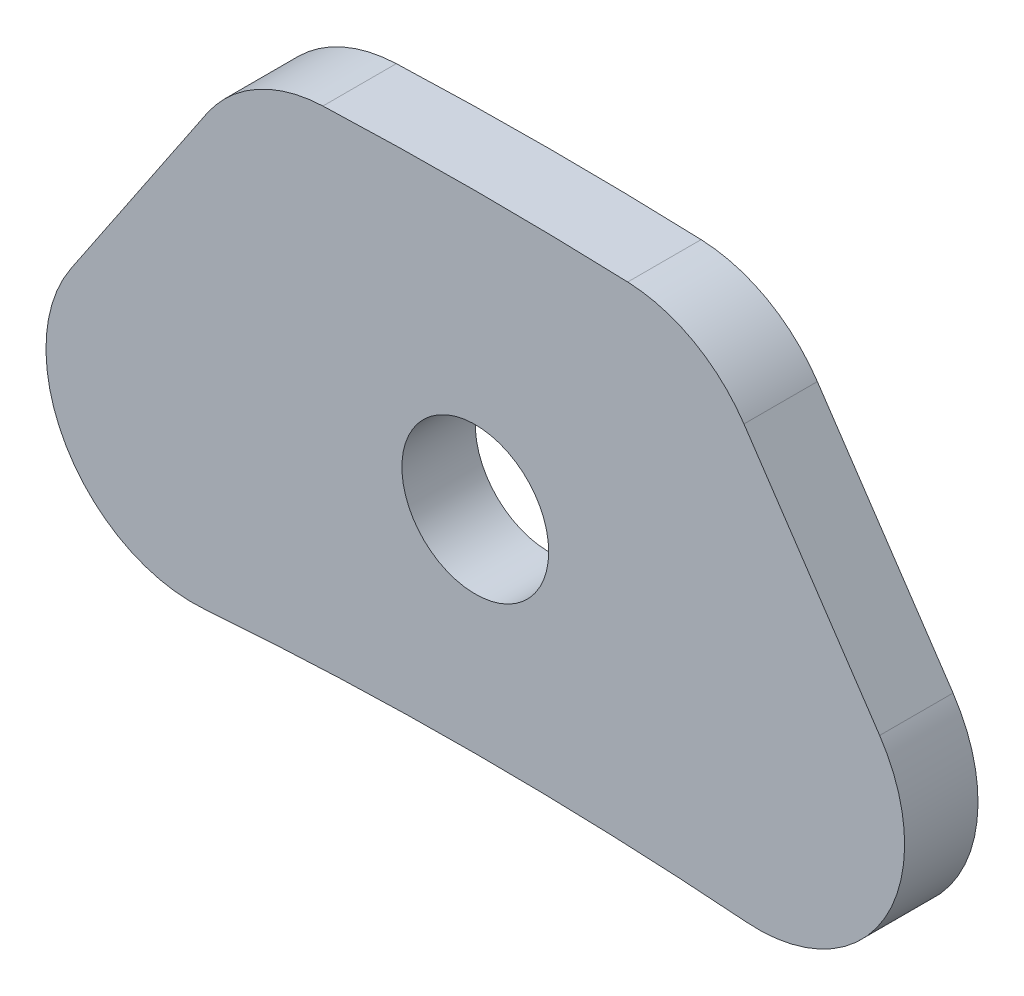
SolidWorks part; units mm, degrees
ref_plane "Front Plane" through (0, 0, 0) normal (0, 0, 1) x (1, 0, 0)
ref_plane "Top Plane" through (0, 0, 0) normal (0, 1, 0) x (1, 0, 0)
ref_plane "Right Plane" through (0, 0, 0) normal (1, 0, 0) x (0, 0, -1)
sketch "Sketch1" plane through (0, 0, 0) normal (0, 0, 1) x (1, 0, 0)
  line L0 (0, 0) -> (0, 113.1226) construction
  line L1 (5.8101, 85.2132) -> (8.7448, 80.8469)
  line L3 (-5.8101, 85.2132) -> (-8.7448, 80.8469)
  circle A0 centre (0, 0) radius 86.6775 construction
  circle A1 centre (0, 0) radius 80.7085 construction
  circle A2 centre (0, 80.7085) radius 1.5875
  circle A3 centre (0, 0) radius 76.1365 construction
  arc A4 (3.2957, 86.6148) -> (-3.2957, 86.6148) centre (0, 0) ccw
  arc A5 (5.8651, 75.9103) -> (-5.8651, 75.9103) centre (0, 0) ccw
  arc A6 (5.8101, 85.2132) -> (3.2957, 86.6148) centre (3.175, 83.4421) ccw
  arc A7 (-5.8101, 85.2132) -> (-3.2957, 86.6148) centre (-3.175, 83.4421) cw
  arc A8 (-5.8651, 75.9103) -> (-8.7448, 80.8469) centre (-6.1097, 79.0758) cw
  arc A9 (8.7448, 80.8469) -> (5.8651, 75.9103) centre (6.1097, 79.0758) cw
  point P17 (-4.9199, 86.5378)
  point P20 (-12.6184, 75.0836)
  point P23 (12.6184, 75.0836)
  dimension "D1" = 173.355
  dimension "D2" = 161.417
  dimension "D3" = 3.175
  dimension "D4" = 152.273
  dimension "D5" = 3.175
  dimension "D7" = 3.175
  dimension "D6" = 6.1097
extrude "Extrude1" add sketch "Sketch1" along normal blind 1.5875
chamfer "Chamfer1" [suppressed] distance 1.27 angle 49
